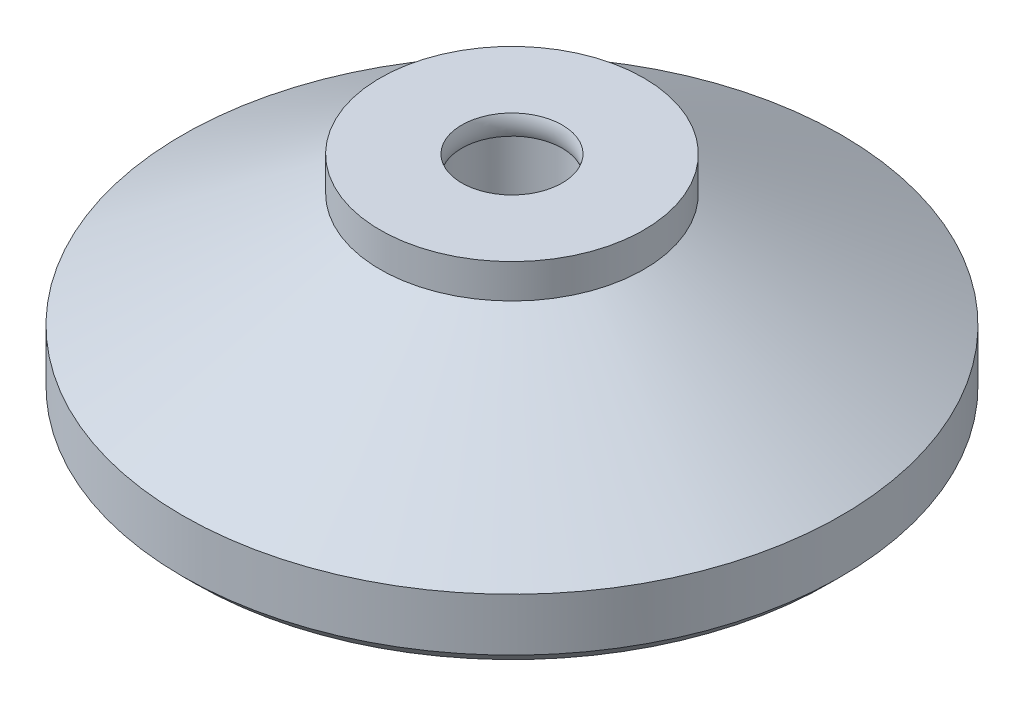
SolidWorks part; units mm, degrees
ref_plane "Front Plane" through (0, 0, 0) normal (0, 0, 1) x (1, 0, 0)
ref_plane "Top Plane" through (0, 0, 0) normal (0, 1, 0) x (1, 0, 0)
ref_plane "Right Plane" through (0, 0, 0) normal (1, 0, 0) x (0, 0, -1)
sketch "Sketch1" plane through (0, 0, 0) normal (0, 1, 0) x (1, 0, 0)
  circle A0 centre (0, 0) radius 8
  dimension "D1" = 16
extrude "Extrude1" add sketch "Sketch1" along normal mid plane 13
sketch "Sketch3" plane through (0, -6.5, 0) normal (0, -1, 0) x (1, 0, 0)
  circle A0 centre (0, 0) radius 20
  dimension "D1" = 40
extrude "Extrude2" add sketch "Sketch3" against normal blind 4
sketch "Sketch4" plane through (0, 0, 0) normal (0, 0, 1) x (1, 0, 0)
  line L0 (-20, -2.5) -> (-8, 4.4282)
  line L1 (-8, 6.5) -> (-8, -2.5) construction
  line L2 (-8, 4.4282) -> (-8, -2.5)
  line L3 (-8, -2.5) -> (-20, -2.5)
  dimension "D1" = 30
revolve "Revolve1" add sketch "Sketch4" angle 360 about axis through (0, 6.5, 0) along (0, -1, 0)
chamfer "Chamfer1" distance 0.8 angle 45 1 edges at (0, -6.5, -20)
sketch "Sketch5" plane through (0, 0, 0) normal (0, 0, 1) x (1, 0, 0)
  line L1 (0, 0) -> (0, 11.3083) construction
  line L2 (0, 6.5) -> (3.05, 6.5)
  line L3 (8, 6.5) -> (-8, 6.5) construction
  line L4 (3.05, 5.28) -> (3.05, -0.7391)
  line L5 (3.05, -0.7391) -> (0, -2.5)
  line L6 (0, -2.5) -> (0, 6.5)
  line L7 (20, -2.5) -> (-20, -2.5) construction
  arc A0 (3.05, 6.5) -> (3.05, 5.28) centre (4.514, 5.89) ccw
  point P14 (2.928, 5.89)
  dimension "D2" = 6.1
  dimension "D1" = 60
  dimension "D3" = 1.22
  dimension "D4" = 0.122
revolve "Cut-Revolve1" cut sketch "Sketch5" angle 360 about L1
equation "\"D3@Sketch5\" = \"D2@Sketch5\"*0.2"
equation "\"D4@Sketch5\" = \"D3@Sketch5\"*0.1"
